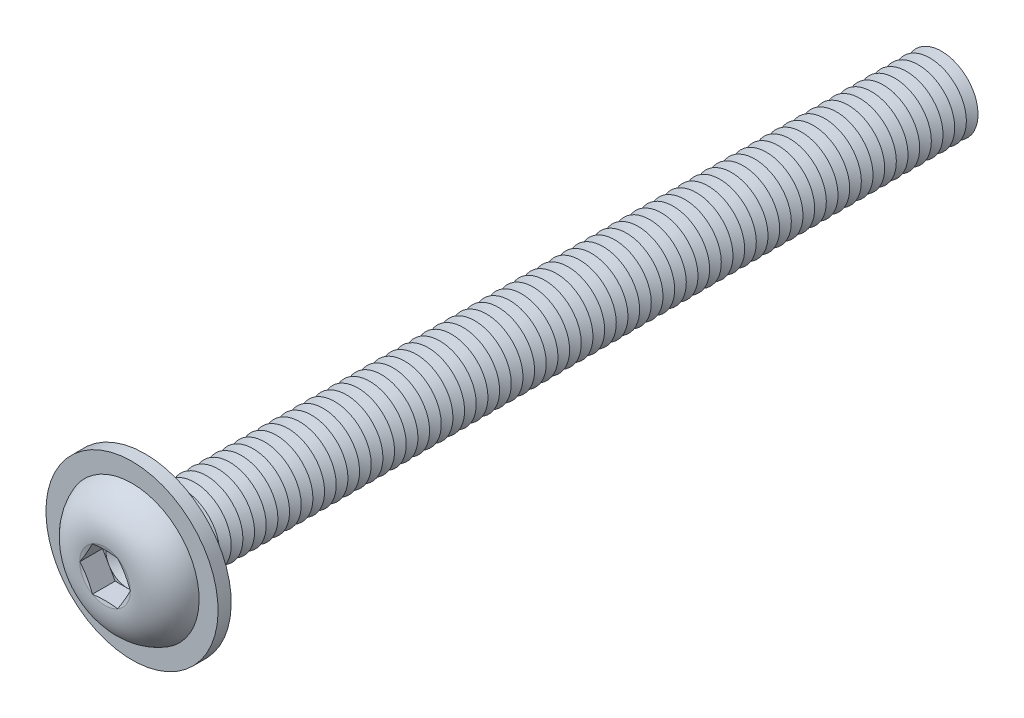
SolidWorks part; units mm, degrees
ref_plane "Front Plane" through (0, 0, 0) normal (0, 0, 1) x (1, 0, 0)
ref_plane "Top Plane" through (0, 0, 0) normal (0, 1, 0) x (1, 0, 0)
ref_plane "Right Plane" through (0, 0, 0) normal (1, 0, 0) x (0, 0, -1)
sketch "Sketch1" plane through (0, 0, 0) normal (1, 0, 0) x (0, 0, -1)
  line L0 (0, 2.5) -> (0, 4.75)
  line L3 (0, 2.5) -> (55, 2.5)
  line L4 (55, 2.5) -> (55, 0)
  line L5 (55, 0) -> (-2.75, 0) construction
  line L6 (-2.75, 0) -> (55, 0)
  line L7 (-2.75, 1.732) -> (-2.75, 0.866) construction
  line L8 (-2.75, 0.866) -> (-2.75, 0)
  line L9 (-2.75, 1.732) -> (-2.5179, 0.866)
  line L10 (-2.5179, 0.866) -> (-2.75, 0.866)
  line L11 (55, 0) -> (22.7481, 0) construction
  line L12 (0, 4.75) -> (-2.75, 4.75) construction
  arc A1 (0, 4.75) -> (-2.75, 1.732) centre (0, 1.9881) ccw
  point P8 (55, 1.25)
  dimension "D1" = 9.5
  dimension "D2" = 5
  dimension "D3" = 2.75
  dimension "D4" = 3.4641
  dimension "D5" = 55
  dimension "D6" = 15
revolve "Revolve1" add sketch "Sketch1" angle 360 about L5
fillet "Fillet1" radius 0.4 1 edges at (0, 2.5, 0)
sketch "Sketch2" plane through (0, 0, 0) normal (1, 0, 0) x (0, 0, -1)
  line L0 (54.6, 2.5) -> (55.4, 2.5)
  line L1 (55, 2.5) -> (0.4, 2.5) construction
  line L2 (55.4, 2.5) -> (55, 1.8072)
  line L3 (55, -2.5) -> (55, 2.5) construction
  line L4 (55, 1.8072) -> (54.6, 2.5)
  dimension "D1" = 0.8
revolve "Cut-Revolve1" cut sketch "Sketch2" angle 360 about axis through (0, 0, -55) along (0, 0, -1)
pattern_linear "LPattern1" count 68 spacing 0.8 along (0, 0, 1) of "Cut-Revolve1"
sketch "Sketch3" plane through (0, 0, 2.75) normal (0, 0, 1) x (1, 0, 0)
  line L7 (0.866, 1.5) -> (-0.866, 1.5)
  line L8 (-0.866, 1.5) -> (-1.7321, 0)
  line L9 (-1.7321, 0) -> (-0.866, -1.5)
  line L10 (-0.866, -1.5) -> (0.866, -1.5)
  line L11 (0.866, -1.5) -> (1.732, 0)
  line L12 (1.732, 0) -> (0.866, 1.5)
  circle A0 centre (0, 0) radius 1.5 construction
  circle A3 centre (0, 0) radius 1.7321 construction
extrude "Cut-Extrude1" cut sketch "Sketch3" against normal blind 1.56
sketch "Sketch4" plane through (0, 0, 1.19) normal (0, 0, 1) x (1, 0, 0)
  line L1 (0.866, 1.5) -> (-0.866, 1.5) construction
  circle A0 centre (0, 0) radius 1.5
extrude "Cut-Extrude2" cut sketch "Sketch4" against normal through all draft 60
sketch "Sketch5" plane through (0, 0, 0) normal (0, 0, -1) x (-1, 0, 0)
  circle A0 centre (0, 0) radius 5.9
  circle A1 centre (0, 0) radius 2.9
  circle A2 centre (0, 0) radius 2.9 construction
  dimension "D1" = 11.8
extrude "Boss-Extrude1" add sketch "Sketch5" against normal blind 0.9
